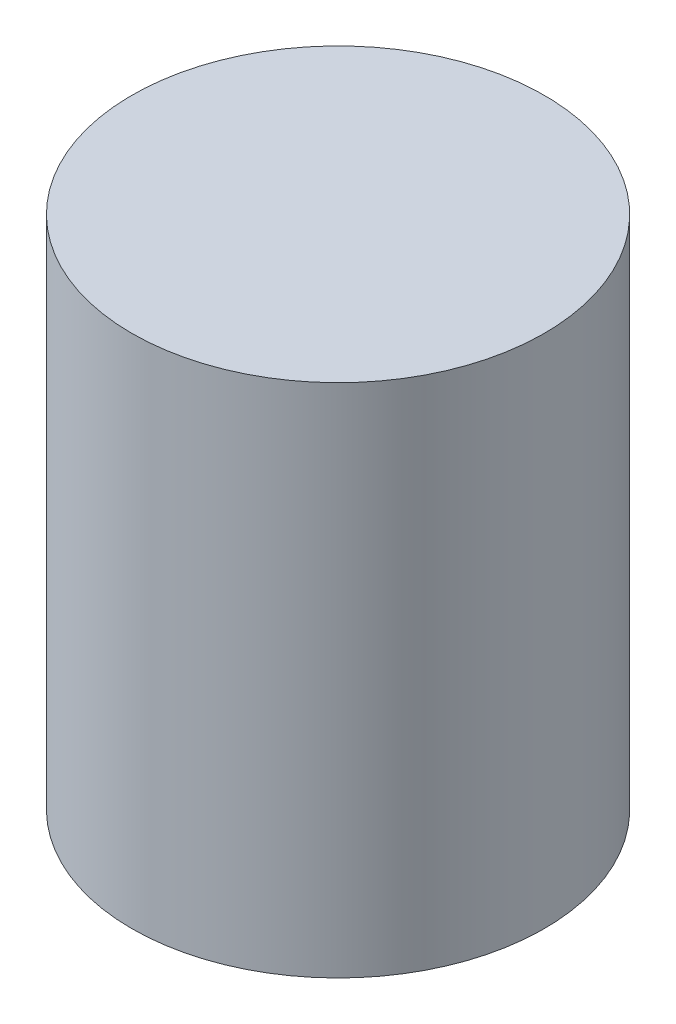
SolidWorks part; units mm, degrees
ref_plane "Front Plane" through (0, 0, 0) normal (0, 0, 1) x (1, 0, 0)
ref_plane "Top Plane" through (0, 0, 0) normal (0, 1, 0) x (1, 0, 0)
ref_plane "Right Plane" through (0, 0, 0) normal (1, 0, 0) x (0, 0, -1)
sketch "Sketch1" plane through (0, 0, 0) normal (0, 1, 0) x (1, 0, 0)
  circle A0 centre (0, 0) radius 4
  dimension "D1" = 8
extrude "Extrude1" add sketch "Sketch1" along normal blind 10
sketch "Sketch2" plane through (0, 10, 0) normal (0, 1, 0) x (-1, 0, 0)
  point P0 (0, -1.905)
  point P1 (0, 1.905)
  dimension "D1" = 1.905
  dimension "D2" = 3.81
